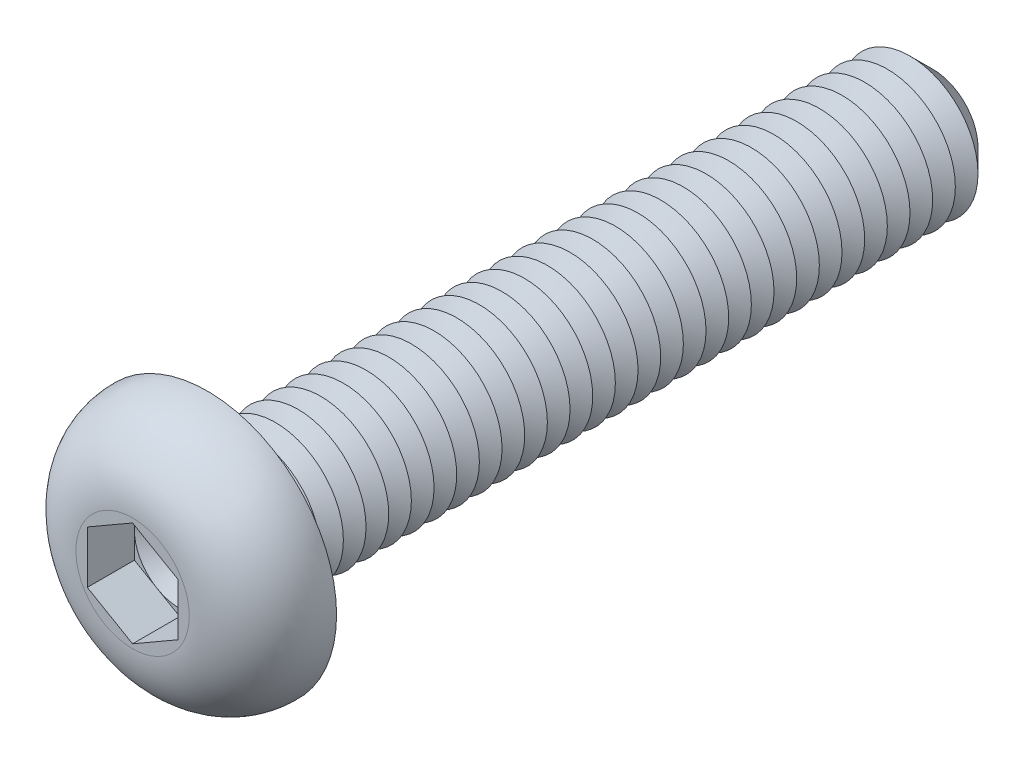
SolidWorks part; units mm, degrees
ref_plane "Front Plane" through (0, 0, 0) normal (0, 0, 1) x (1, 0, 0)
ref_plane "Top Plane" through (0, 0, 0) normal (0, 1, 0) x (1, 0, 0)
ref_plane "Right Plane" through (0, 0, 0) normal (1, 0, 0) x (0, 0, -1)
sketch "Sketch1" plane through (0, 0, 0) normal (1, 0, 0) x (0, 0, -1)
  line L0 (-47.9342, 0) -> (60.3146, 0) construction
sketch "Sketch2" plane through (0, 0, 0) normal (1, 0, 0) x (0, 0, -1)
  line L0 (0, 0) -> (-1.65, 0)
  line L1 (-47.9342, 0) -> (60.3146, 0) construction
  line L2 (-1.65, 0) -> (-1.65, 1.2508)
  line L3 (0, 2.85) -> (0, 0)
  arc A0 (-1.65, 1.2508) -> (0, 2.85) centre (-0.05, 1.2508) cw
  dimension "D1" = 1.6
  dimension "D2" = 1.65
  dimension "D3" = 2.85
revolve "Revolve1" add sketch "Sketch2" angle 360 about L0
sketch "Sketch3" plane through (0, 0, 1.65) normal (0, 0, 1) x (1, 0, 0)
  line L1 (0, 1.1547) -> (-1, 0.5774)
  line L2 (-1, 0.5774) -> (-1, -0.5774)
  line L3 (-1, -0.5774) -> (0, -1.1547)
  line L4 (0, -1.1547) -> (1, -0.5774)
  line L5 (1, -0.5774) -> (1, 0.5774)
  line L6 (1, 0.5774) -> (0, 1.1547)
  circle A0 centre (0, 0) radius 1 construction
  dimension "D1" = 2
extrude "Cut-Extrude1" cut sketch "Sketch3" against normal blind 1.04
sketch "Sketch4" plane through (0, 0, 0) normal (0, 0, -1) x (-1, 0, 0)
  circle A0 centre (0, 0) radius 1.5
  dimension "D1" = 3
extrude "Boss-Extrude1" add sketch "Sketch4" along normal blind 16
chamfer "Chamfer1" distance 0.5 angle 45 1 edges at (-1.5, 0, -16)
sketch "Sketch5" plane through (0, 0, 0) normal (1, 0, 0) x (0, 0, -1)
  line L0 (0.5, 1.5) -> (1, 1.5)
  line L1 (15.5, 1.5) -> (0, 1.5) construction
  line L2 (1, 1.5) -> (0.75, 1.067)
  line L3 (0.75, 1.067) -> (0.5, 1.5)
  line L4 (0, -2.85) -> (0, 2.85) construction
  line L5 (15.5, 1.5) -> (0, 1.5) construction
  dimension "D1" = 0.5
  dimension "D2" = 0.5
revolve "Cut-Revolve1" cut sketch "Sketch5" angle 360 about L0
pattern_linear "LPattern1" count 30 spacing 0.5 along (0, 0, -1) of "Cut-Revolve1"
fillet "Fillet2" radius 0.2 1 edges at (1.5, 0, 0)
sketch "Sketch6" plane through (0, 0, 0.61) normal (0, 0, 1) x (1, 0, 0)
  line L0 (0, -1.1547) -> (1, -0.5774) construction
  circle A0 centre (0, 0) radius 1
extrude "Cut-Extrude2" cut sketch "Sketch6" against normal through all draft 60
